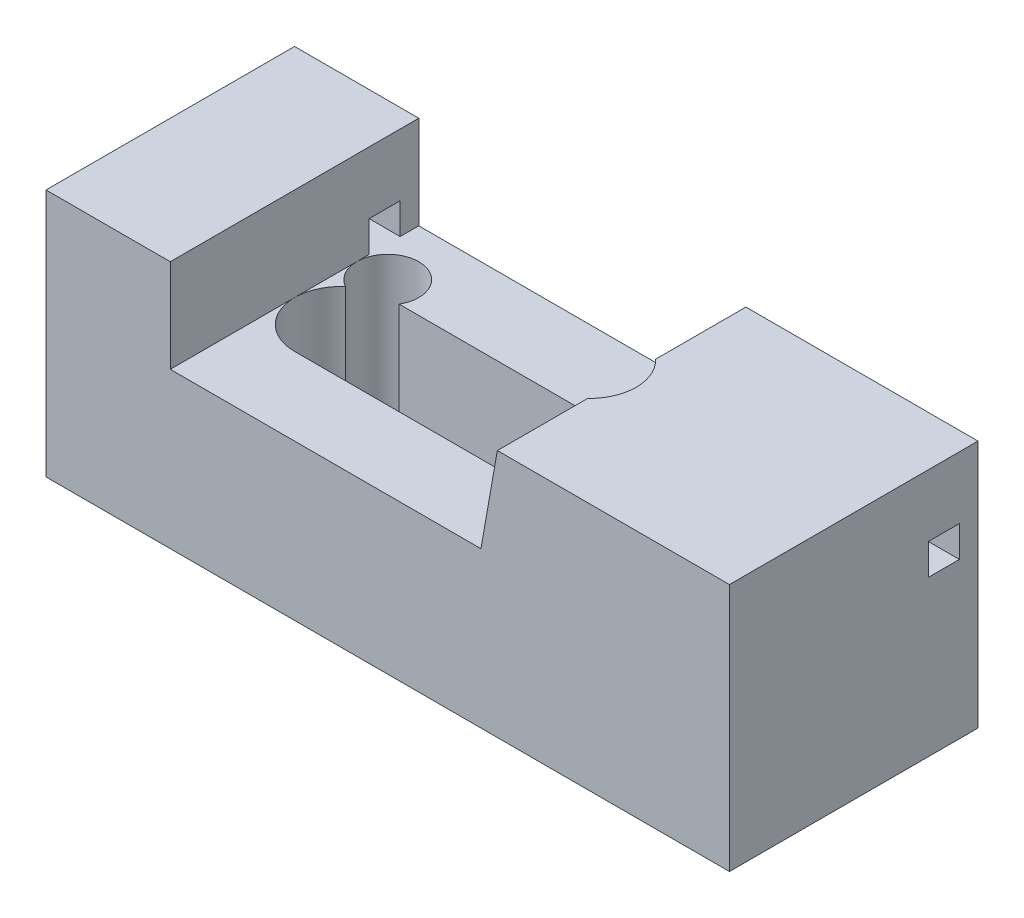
SolidWorks part; units mm, degrees
ref_plane "Ebene vorne" through (0, 0, 0) normal (0, 0, 1) x (1, 0, 0)
ref_plane "Ebene oben" through (0, 0, 0) normal (0, 1, 0) x (1, 0, 0)
ref_plane "Ebene rechts" through (0, 0, 0) normal (1, 0, 0) x (0, 0, -1)
sketch "Skizze1" plane through (0, 0, 0) normal (0, 0, 1) x (1, 0, 0)
  line L0 (0, 0) -> (110, 0)
  line L1 (110, 0) -> (110, 40)
  line L2 (110, 40) -> (70, 40)
  line L3 (70, 40) -> (70, 25)
  line L4 (70, 25) -> (20, 25)
  line L5 (20, 25) -> (20, 40)
  line L6 (20, 40) -> (0, 40)
  line L7 (0, 40) -> (0, 0)
  dimension "D1" = 110
  dimension "D2" = 20
  dimension "D3" = 40
  dimension "D4" = 40
  dimension "D5" = 15
  dimension "D6" = 40
extrude "Linear austragen1" add sketch "Skizze1" along normal blind 40
draft "Formschräge1" type of draft neutral plane draft angle 10 faces to draft 1 parameters "D1"=10
sketch "Skizze2" plane through (0, 0, 0) normal (0, 1, 0) x (-1, 0, 0)
  line L0 (-27.5, 27.5) -> (-67.5, 27.5)
  line L1 (-67.5, 12.5) -> (-27.5, 12.5)
  line L2 (-70, 40) -> (-20, 40) construction
  line L5 (0, 40) -> (0, 0) construction
  arc A0 (-67.5, 27.5) -> (-67.5, 12.5) centre (-67.5, 20) ccw
  arc A1 (-27.5, 12.5) -> (-27.5, 27.5) centre (-27.5, 20) ccw
  dimension "D4" = 27.5
  dimension "D1" = 20
  dimension "D2" = 15
  dimension "D3" = 40
extrude "Schnitt-Linear austragen1" cut sketch "Skizze2" along normal through all
sketch "Skizze3" plane through (0, 40, 0) normal (0, 1, 0) x (-1, 0, 0)
  line L0 (-20, 0) -> (0, 0) construction
  line L1 (0, 40) -> (0, 0) construction
  circle A0 centre (-25, 10) radius 5
  dimension "D1" = 10
  dimension "D2" = 10
  dimension "D3" = 25
extrude "Schnitt-Linear austragen2" cut sketch "Skizze3" against normal through all
sketch "Skizze4" plane through (0, 0, 0) normal (-1, 0, 0) x (0, 0, 1)
  line L0 (40, 40) -> (0, 40) construction
  line L1 (3, 30) -> (8, 30)
  line L2 (3, 30) -> (3, 25)
  line L3 (3, 25) -> (8, 25)
  line L4 (8, 30) -> (8, 25)
  line L5 (0, 40) -> (0, 0) construction
  dimension "D1" = 5
  dimension "D2" = 5
  dimension "D3" = 10
  dimension "D4" = 3
extrude "Schnitt-Linear austragen3" cut sketch "Skizze4" against normal through all
